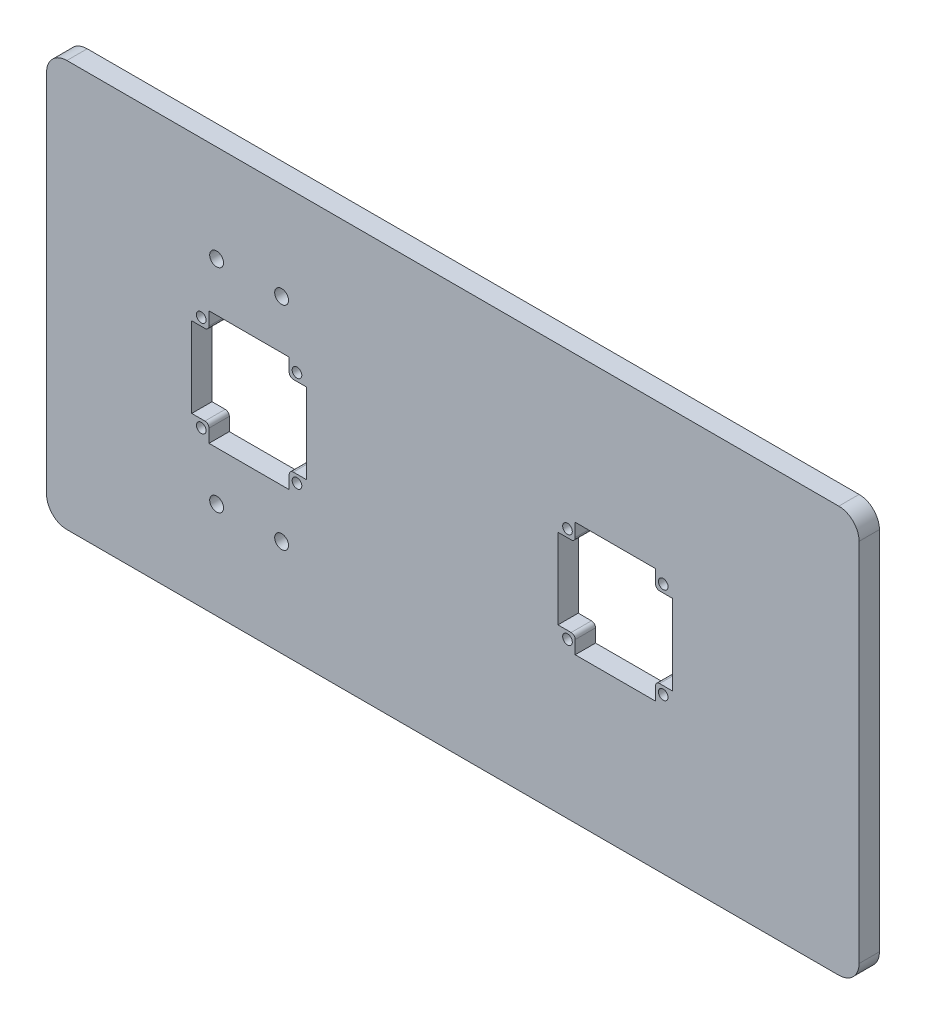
SolidWorks part; units mm, degrees
ref_plane "Front Plane" through (0, 0, 0) normal (0, 0, 1) x (1, 0, 0)
ref_plane "Top Plane" through (0, 0, 0) normal (0, 1, 0) x (1, 0, 0)
ref_plane "Right Plane" through (0, 0, 0) normal (1, 0, 0) x (0, 0, -1)
sketch "Sketch1" plane through (0, 0, 0) normal (0, 0, 1) x (1, 0, 0)
  line L0 (-120.05, 19.75) -> (-120.05, 28.25)
  line L1 (200, -100) -> (-200, -100)
  line L2 (200, -100) -> (200, 100)
  line L3 (200, 100) -> (-200, 100)
  line L4 (-200, -100) -> (-200, 100)
  line L5 (200, -100) -> (-200, 100) construction
  line L6 (200, 100) -> (-200, -100) construction
  line L11 (51.75, 28.25) -> (60.25, 28.25)
  line L12 (51.75, 28.25) -> (51.75, 19.75)
  line L13 (-128.55, -28.25) -> (-72.05, -28.25)
  line L14 (-128.55, -28.25) -> (-128.55, 28.25)
  line L15 (-128.55, 28.25) -> (-72.05, 28.25)
  line L16 (-72.05, -28.25) -> (-72.05, 28.25)
  line L17 (-128.55, -28.25) -> (-72.05, 28.25) construction
  line L18 (-128.55, 28.25) -> (-72.05, -28.25) construction
  line L19 (51.75, 28.25) -> (108.25, 28.25)
  line L20 (51.75, 28.25) -> (51.75, -28.25)
  line L21 (51.75, -28.25) -> (108.25, -28.25)
  line L22 (108.25, 28.25) -> (108.25, -28.25)
  line L23 (51.75, 28.25) -> (108.25, -28.25) construction
  line L24 (51.75, -28.25) -> (108.25, 28.25) construction
  line L29 (-128.55, 28.25) -> (-120.05, 28.25)
  line L30 (-128.55, 28.25) -> (-128.55, 19.75)
  line L31 (-128.55, 19.75) -> (-120.05, 19.75)
  line L33 (-72.05, 28.25) -> (-80.55, 28.25)
  line L34 (-72.05, 28.25) -> (-72.05, 19.75)
  line L35 (-72.05, 19.75) -> (-80.55, 19.75)
  line L36 (-80.55, 28.25) -> (-80.55, 19.75)
  line L37 (-72.05, -28.25) -> (-80.55, -28.25)
  line L38 (-72.05, -28.25) -> (-72.05, -19.75)
  line L39 (-72.05, -19.75) -> (-80.55, -19.75)
  line L40 (-80.55, -28.25) -> (-80.55, -19.75)
  line L41 (-128.55, -28.25) -> (-120.05, -28.25)
  line L42 (-128.55, -28.25) -> (-128.55, -19.75)
  line L43 (-128.55, -19.75) -> (-120.05, -19.75)
  line L44 (-120.05, -28.25) -> (-120.05, -19.75)
  line L45 (51.75, 19.75) -> (60.25, 19.75)
  line L46 (60.25, 28.25) -> (60.25, 19.75)
  line L47 (108.25, 28.25) -> (99.75, 28.25)
  line L48 (108.25, 28.25) -> (108.25, 19.75)
  line L49 (108.25, 19.75) -> (99.75, 19.75)
  line L50 (99.75, 28.25) -> (99.75, 19.75)
  line L51 (108.25, -28.25) -> (99.75, -28.25)
  line L52 (108.25, -28.25) -> (108.25, -19.75)
  line L53 (108.25, -19.75) -> (99.75, -19.75)
  line L54 (99.75, -28.25) -> (99.75, -19.75)
  line L55 (51.75, -28.25) -> (60.25, -28.25)
  line L56 (51.75, -28.25) -> (51.75, -19.75)
  line L57 (51.75, -19.75) -> (60.25, -19.75)
  line L58 (60.25, -28.25) -> (60.25, -19.75)
  point P0 (0, 0)
  point P7 (-100.3, 0)
  point P13 (-100.3, 0)
  point P18 (80, 0)
  point P23 (-100.3, 0)
  dimension "D1" = 400
  dimension "D2" = 200
  dimension "D3" = 80
  dimension "D4" = 8.5
  dimension "D5" = 56.5
  dimension "D6" = 56.5
  dimension "D7" = 8.5
  dimension "D8" = 56.5
  dimension "D9" = 56.5
  dimension "D10" = 8.5
  dimension "D11" = 8.5
  dimension "D12" = 100.3
  dimension "D14" = 8.5
  dimension "D15" = 8.5
  dimension "D16" = 8.5
  dimension "D17" = 8.5
  dimension "D18" = 8.5
  dimension "D19" = 8.5
  dimension "D20" = 8.5
extrude "Boss-Extrude1" add sketch "Sketch1" along normal blind 10 contours L4 L1 L2 L3 L16 L13 L14 L15 L19 L22 L21 L20 L12 L11 | L14 L31 L0 L15 | L15 L36 L35 L16 | L40 L13 L16 L39 | L13 L44 L43 L14 | L21 L58 L57 L20 | L46 L11 L12 L45 | L19 L50 L49 L22 | L54 L21 L22 L53
fillet "Fillet2" radius 2 8 edges at (99.75, 19.75, 5) (-120.05, -19.75, 5) (-80.55, -19.75, 5) (-80.55, 19.75, 5) (-120.05, 19.75, 5) (60.25, -19.75, 5) (99.75, -19.75, 5) (60.25, 19.75, 5)
sketch "Sketch2" plane through (0, 0, 0) normal (0, 0, -1) x (-1, 0, 0)
  line L19 (-51.75, 19.75) -> (-51.75, -19.75) construction
  line L22 (-79.85, 0) -> (-79.85, 22.4726)
  line L23 (10.15, 0) -> (10.15, 22.4726)
  circle A8 centre (-103.57, 23.57) radius 2.375
  circle A9 centre (-56.43, 23.57) radius 2.375
  circle A10 centre (-56.43, -23.57) radius 2.375
  circle A11 centre (-103.57, -23.57) radius 2.375
  circle A12 centre (123.87, -23.57) radius 2.375
  circle A13 centre (76.73, -23.57) radius 2.375
  circle A14 centre (76.73, 23.57) radius 2.375
  circle A15 centre (123.87, 23.57) radius 2.375
  point P8 (0, 0)
  point P11 (0, 0)
  point P29 (0, 0)
  point P32 (0, 0)
  dimension "D1" = 4.75
  dimension "D2" = 4.75
  dimension "D3" = 4.75
  dimension "D4" = 4.75
  dimension "D5" = 47.14
  dimension "D6" = 47.14
  dimension "D7" = 56.43
  dimension "D8" = 23.57
  dimension "D9" = 28.1
  dimension "D10" = 90
extrude "Cut-Extrude1" cut sketch "Sketch2" against normal up to next
fillet "Fillet3" radius 10 4 edges at (-200, -100, 5) (-200, 100, 5) (200, -100, 5) (200, 100, 5)
sketch "Sketch3" plane through (0, 0, 0) normal (0, 0, -1) x (-1, 0, 0)
  line L0 (72.05, -19.75) -> (72.05, 19.75) construction
  line L1 (100.3, 0) -> (100.3, 23.3041) construction
  line L5 (120.05, -28.25) -> (80.55, -28.25) construction
  line L7 (120.05, 28.25) -> (80.55, 28.25) construction
  circle A0 centre (84.3, -52.25) radius 3.4
  circle A1 centre (116.3, -52.25) radius 3.4
  circle A2 centre (84.3, 52.25) radius 3.4
  circle A3 centre (116.3, 52.25) radius 3.4
  point P5 (84.3, -52.25)
  point P6 (116.3, -52.25)
  dimension "D5" = 16
  dimension "D3" = 6.8
  dimension "D4" = 6.8
  dimension "D7" = 6.8
  dimension "D8" = 6.8
  dimension "D1" = 24
  dimension "D2" = 24
  dimension "D6" = 32
  dimension "D9" = 28.25
extrude "Cut-Extrude3" cut sketch "Sketch3" against normal blind 20
